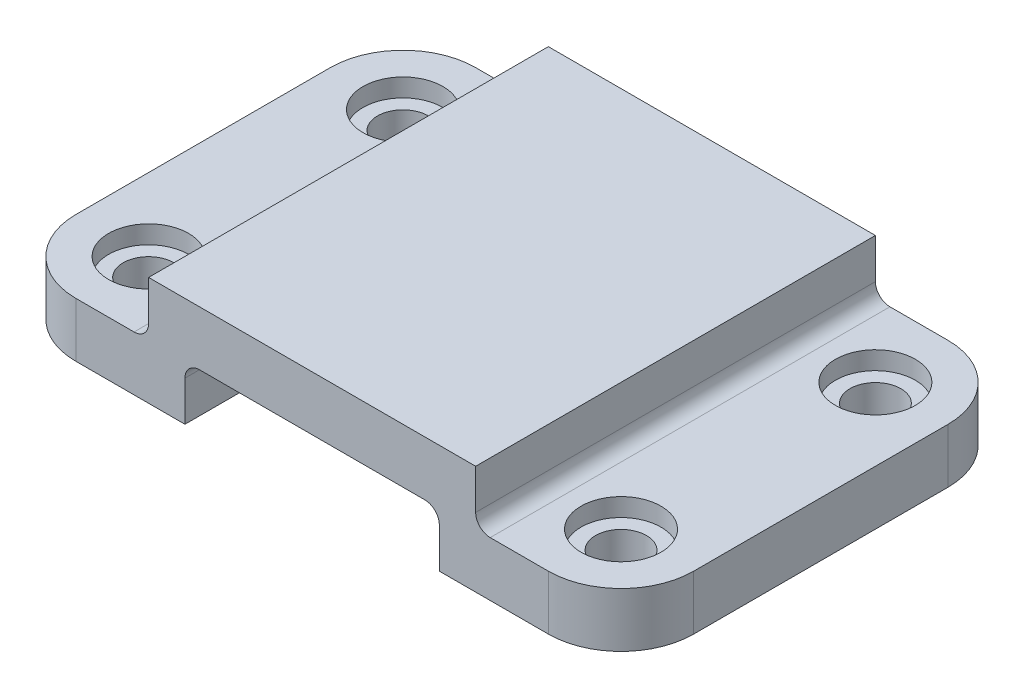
SolidWorks part; units mm, degrees
ref_plane "Front" through (0, 0, 0) normal (0, 0, 1) x (1, 0, 0)
ref_plane "Top" through (0, 0, 0) normal (0, 1, 0) x (1, 0, 0)
ref_plane "Right" through (0, 0, 0) normal (1, 0, 0) x (0, 0, -1)
sketch "Sketch2" plane through (0, 0, 0) normal (0, 0, 1) x (1, 0, 0)
  line L0 (0, 9.525) -> (0, -9.525)
  line L1 (0, -9.525) -> (44.45, -9.525)
  line L2 (44.45, -9.525) -> (44.45, -28.575)
  line L3 (44.45, -28.575) -> (107.95, -28.575)
  line L4 (107.95, -28.575) -> (107.95, -9.525)
  line L5 (107.95, -9.525) -> (57.15, -9.525)
  line L6 (57.15, -9.525) -> (57.15, 9.525)
  line L7 (57.15, 9.525) -> (0, 9.525)
  dimension "D1" = 57.15
  dimension "D2" = 107.95
  dimension "D3" = 19.05
  dimension "D4" = 19.05
  dimension "D5" = 19.05
  dimension "D6" = 63.5
extrude "Extrude1" add sketch "Sketch2" along normal blind 69.85
fillet "Fillet1" radius 25.4
sketch "Sketch3" plane through (0, -9.525, 0) normal (0, 1, 0) x (-1, 0, 0)
  circle A0 centre (-82.55, 25.4) radius 8.89
  arc A1 (-107.95, 25.4) -> (-82.55, 0) centre (-82.55, 25.4) ccw construction
  dimension "D1" = 17.78
extrude "Cut-Extrude1" cut sketch "Sketch3" against normal through all
sketch "Sketch4" plane through (0, -9.525, 0) normal (0, 1, 0) x (-1, 0, 0)
  arc A2 (-68.58, 25.4) -> (-68.58, 25.4) centre (-82.55, 25.4) ccw
  circle A3 centre (-82.55, 25.4) radius 13.97
  dimension "D1" = 5.08
extrude "Cut-Extrude2" cut sketch "Sketch4" against normal blind 6.35
fillet "Fillet2" radius 5.08
mirror "Mirror1"
mirror "Mirror2"
